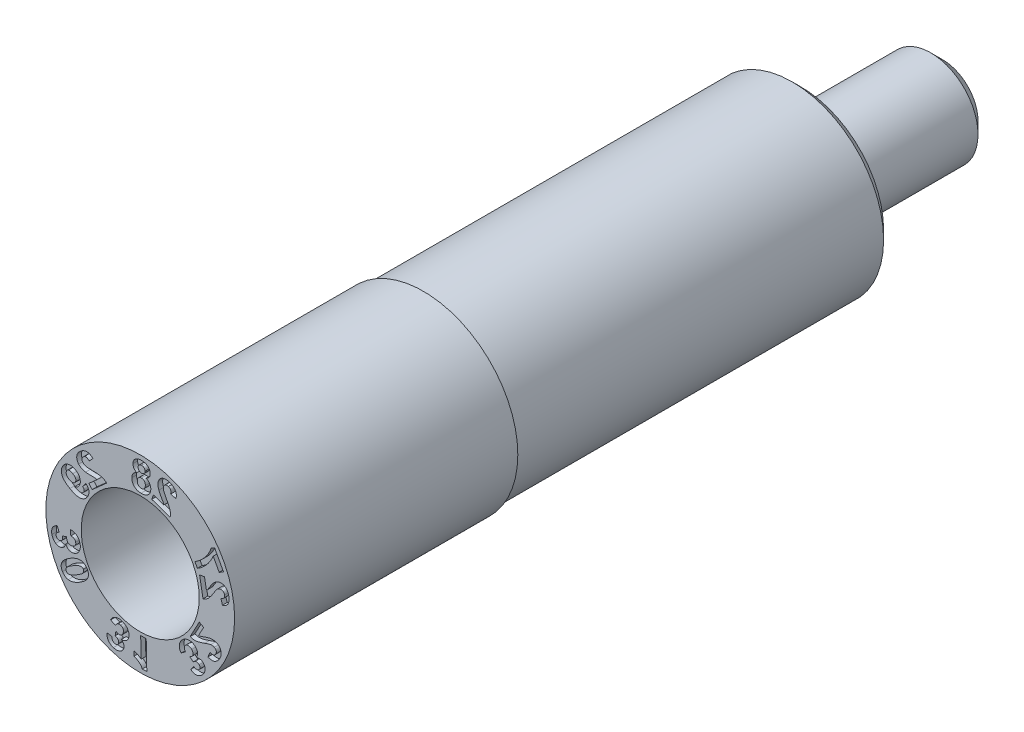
SolidWorks part; units mm, degrees
other "<M2 X .4 SHSS>-<Revolve1>"
ref_plane "Front Plane" through (0, 0, 0) normal (0, 0, 1) x (1, 0, 0)
ref_plane "Top Plane" through (0, 0, 0) normal (0, 1, 0) x (1, 0, 0)
ref_plane "Right Plane" through (0, 0, 0) normal (1, 0, 0) x (0, 0, -1)
sketch "Sketch1" plane through (0, 0, 0) normal (1, 0, 0) x (0, 0, -1)
  line L2 (0, 2) -> (0, 1.25)
  line L3 (13.75, 2) -> (0, 2)
  line L4 (-3.7979, 0) -> (49996.2021, 0) construction
  line L8 (11, 0.7) -> (2.3, 0.7)
  line L9 (2.3, 1.25) -> (2.3, 0.7)
  line L10 (2.3, 1.25) -> (0, 1.25)
  line L12 (14, 1) -> (14, 1.75)
  line L16 (14, 1.75) -> (13.75, 2)
  line L17 (14, 1) -> (11, 1)
  line L18 (11, 0.7) -> (11, 1)
  dimension "D1" = 14
  dimension "D2" = 45
  dimension "D3" = 0.25
  dimension "D4" = 4
  dimension "D5" = 2.5
  dimension "D6" = 2.3
  dimension "D7" = 1.4
  dimension "D8" = 2
  dimension "D9" = 3
revolve "Revolve1" add sketch "Sketch1" angle 360 about L4
sketch "Sketch5" plane through (0, 0, 0) normal (1, 0, 0) x (0, 0, -1)
  line L0 (0, 0) -> (50000, 0) construction
  line L1 (0, 2) -> (0, -2) construction
  line L2 (6, 1.935) -> (14, 1.935)
  line L3 (6, 1.935) -> (6, 2.935)
  line L4 (6, 2.935) -> (14, 2.935)
  line L5 (14, 1.935) -> (14, 2.935)
  line L6 (14, -1.75) -> (14, 1.75) construction
  line L7 (13.75, 2) -> (0, 2) construction
  dimension "D1" = 6
  dimension "D2" = 0.065
  dimension "D3" = 1
revolve "Cut-Revolve1" cut sketch "Sketch5" angle 360 about L0
sketch "Sketch2" plane through (0, 0, 0) normal (0, 0, 1) x (1, 0, 0)
  line L0 (0, 0) -> (0, 2.3112) construction
  line L1 (0, 0) -> (2.0015, 1.1556) construction
  line L2 (0, 0) -> (2.0015, -1.1556) construction
  line L3 (0, 0) -> (0, -2.3112) construction
  line L4 (0, 0) -> (-2.0015, -1.1556) construction
  line L5 (0, 0) -> (-2.0015, 1.1556) construction
  circle A0 centre (0, 0) radius 1.3343 construction
  text T0 "27   28   29   30   31   32" font "Arial" height 0.6
  point P10 (0, 0)
  point P746 (4, 0.001)
  point P747 (0.0034, 0.0034)
  point P748 (0.0034, 0)
  dimension "D1" = 6
extrude "Cut-Extrude1" cut sketch "Sketch2" against normal blind 0.1
sketch "Sketch3" plane through (0, 0, -2.3) normal (0, 0, 1) x (1, 0, 0)
  line L0 (0, 0) -> (0, 50000) construction
  line L1 (0.4041, 0.7) -> (-0.4041, 0.7)
  line L2 (-0.4041, 0.7) -> (-0.8083, 0)
  line L3 (-0.8083, 0) -> (-0.4041, -0.7)
  line L4 (-0.4041, -0.7) -> (0.4041, -0.7)
  line L5 (0.4041, -0.7) -> (0.8083, 0)
  line L6 (0.8083, 0) -> (0.4041, 0.7)
  line L7 (0, 0) -> (50000, 0) construction
  circle A0 centre (0, 0) radius 0.7 construction
  circle A1 centre (0, 0) radius 0.7 construction
extrude "Cut-Extrude2" cut sketch "Sketch3" against normal blind 1.4
inserted part "M2 X .4 SHSS"
move or copy body "Body-Move/Copy2" placed by mates yes
